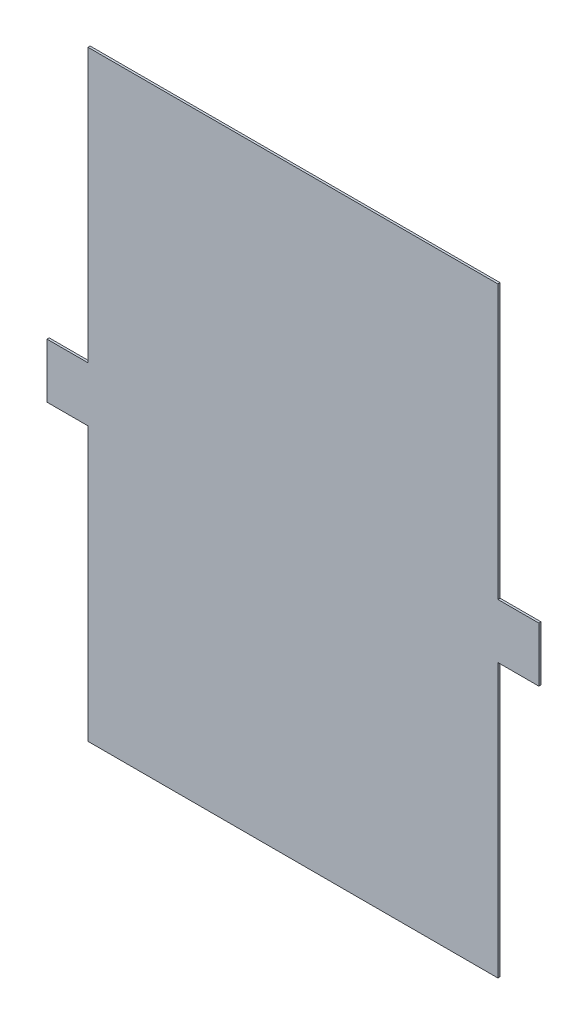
SolidWorks part; units mm, degrees
ref_plane "Front Plane" through (0, 0, 0) normal (0, 0, 1) x (1, 0, 0)
ref_plane "Top Plane" through (0, 0, 0) normal (0, 1, 0) x (1, 0, 0)
ref_plane "Right Plane" through (0, 0, 0) normal (1, 0, 0) x (0, 0, -1)
sketch "Sketch1" plane through (0, 0, 0) normal (0, 0, 1) x (1, 0, 0)
  line L0 (129.4319, 13.961) -> (167.5319, 13.961)
  line L1 (-251.5681, 267.961) -> (129.4319, 267.961)
  line L2 (-251.5681, 267.961) -> (-251.5681, 13.961)
  line L3 (-251.5681, -290.839) -> (129.4319, -290.839)
  line L4 (129.4319, 267.961) -> (129.4319, 13.961)
  line L5 (167.5319, 13.961) -> (167.5319, -36.839)
  line L6 (167.5319, -36.839) -> (129.4319, -36.839)
  line L7 (-251.5681, 13.961) -> (-289.6681, 13.961)
  line L8 (-289.6681, 13.961) -> (-289.6681, -36.839)
  line L9 (-289.6681, -36.839) -> (-251.5681, -36.839)
  line L10 (-251.5681, -36.839) -> (-251.5681, -290.839)
  line L11 (129.4319, -36.839) -> (129.4319, -290.839)
  dimension "D1" = 381
  dimension "D2" = 558.8
  dimension "D3" = 50.8
  dimension "D4" = 254
  dimension "D5" = 38.1
  dimension "D6" = 38.1
  dimension "D7" = 50.8
extrude "Boss-Extrude1" add sketch "Sketch1" along normal blind 2.032
